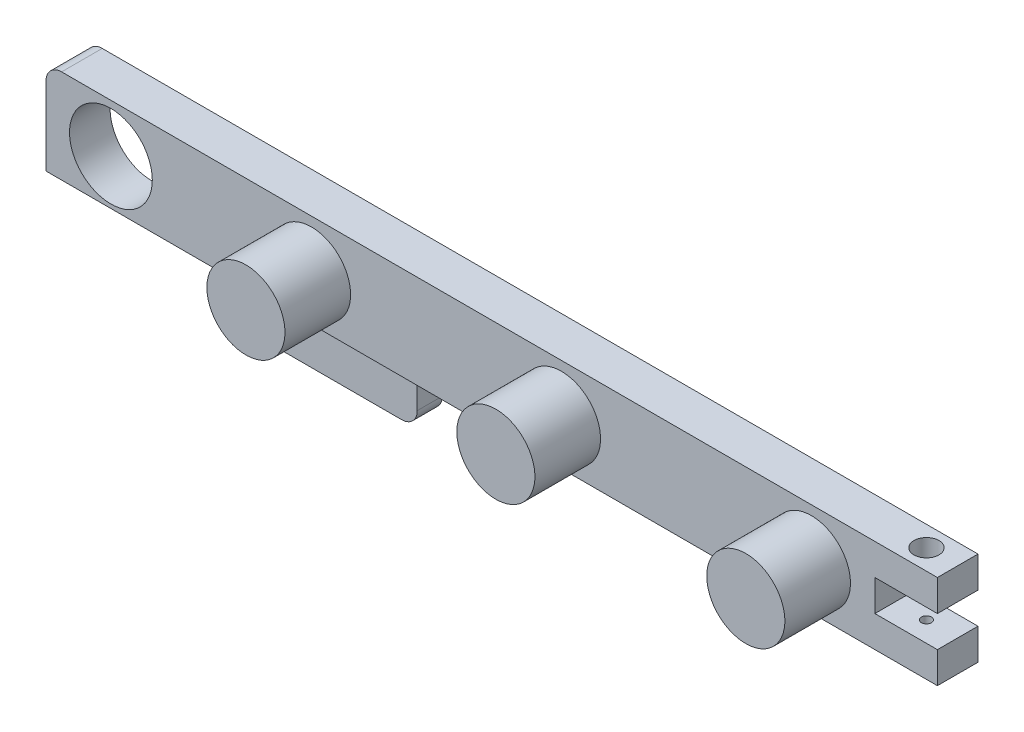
SolidWorks part; units mm, degrees
ref_plane "Front Plane" through (0, 0, 0) normal (0, 0, 1) x (1, 0, 0)
ref_plane "Top Plane" through (0, 0, 0) normal (0, 1, 0) x (1, 0, 0)
ref_plane "Right Plane" through (0, 0, 0) normal (1, 0, 0) x (0, 0, -1)
sketch "Sketch1" plane through (0, 0, 0) normal (0, 0, 1) x (1, 0, 0)
  line L1 (0, 0) -> (355.325, 0)
  line L2 (0, 0) -> (0, 30)
  line L3 (0, 30) -> (355.325, 30)
  line L4 (355.325, 0) -> (355.325, 30)
  line L5 (50, 0) -> (250, 0)
  line L6 (50, 0) -> (50, -17)
  line L7 (50, -17) -> (250, -17)
  line L8 (250, 0) -> (250, -17)
  line L9 (0, 0) -> (355.325, 0)
  line L10 (0, 0) -> (0, -17)
  line L11 (0, -17) -> (355.325, -17)
  line L12 (355.325, 0) -> (355.325, -17)
  line L13 (0, 0) -> (177.6625, 0)
  line L14 (0, 0) -> (0, -17)
  line L15 (0, -17) -> (177.6625, -17)
  line L16 (177.6625, 0) -> (177.6625, -17)
  line L17 (0, 0) -> (50, 0)
  line L18 (0, 0) -> (0, -5)
  line L19 (0, -5) -> (50, -5)
  line L20 (50, 0) -> (50, -5)
  circle A0 centre (20.775, 14.5) radius 12.5
  circle A1 centre (334.55, 14.5) radius 12.5
  circle A2 centre (60, -2.5) radius 1
  circle A3 centre (68, -2.5) radius 1
  circle A4 centre (60, -14.5) radius 1
  circle A5 centre (68, -14.5) radius 1
  dimension "D1" = 25
  dimension "D11" = 2
  dimension "D2" = 313.775
  dimension "D3" = 20.775
  dimension "D4" = 20.775
  dimension "D5" = 30
  dimension "D6" = 15.5
  dimension "D7" = 15.5
  dimension "D8" = 17
  dimension "D9" = 50
  dimension "D10" = 200
  dimension "D12" = 8
  dimension "D13" = 12
  dimension "D14" = 8
  dimension "D15" = 12
  dimension "D16" = 10
  dimension "D17" = 10
  dimension "D18" = 2.5
  dimension "D19" = 2.5
  dimension "D20" = 5
extrude "Boss-Extrude3" add sketch "Sketch1" along normal blind 13 contours L1 L9 L4 L3 L2 A1 A0 | L16 L1 L6 L7 A5 A4 A3 A2 | L10 L19 L6 L1
fillet "Fillet3" radius 5 6 edges at (355.325, 0, 6.5) (355.325, 30, 6.5) (177.6625, -17, 6.5) (50, -17, 6.5) (0, -5, 6.5) (0, 30, 6.5)
sketch "Sketch3" plane through (0, 0, 13) normal (0, 0, 1) x (1, 0, 0)
  line L0 (0, 0) -> (0, 25) construction
  circle A0 centre (85, 14.5) radius 12.5
  circle A1 centre (165, 14.5) radius 12.5
  circle A2 centre (245, 14.5) radius 12.5
  dimension "D1" = 25
  dimension "D2" = 85
  dimension "D3" = 80
  dimension "D4" = 80
extrude "Boss-Extrude4" add sketch "Sketch3" along normal blind 13
sketch "Sketch4" plane through (0, 0, 0) normal (0, 0, -1) x (-1, 0, 0)
  circle A0 centre (-68, -2.5) radius 1.425
  circle A1 centre (-60, -2.5) radius 1.425
  circle A2 centre (-60, -14.5) radius 1.425
  circle A3 centre (-68, -14.5) radius 1.425
  dimension "D1" = 2.85
extrude "Cut-Extrude1" cut sketch "Sketch4" against normal up to next
sketch "Sketch5" plane through (0, 0, 0) normal (0, 0, -1) x (-1, 0, 0)
  line L1 (-177.6625, 0) -> (-113.8325, 0)
  line L2 (-177.6625, 0) -> (-177.6625, -18)
  line L3 (-177.6625, -18) -> (-113.8325, -18)
  line L4 (-113.8325, 0) -> (-113.8325, -18)
  dimension "D1" = 63.83
  dimension "D2" = 18
extrude "Cut-Extrude3" cut sketch "Sketch5" against normal through all
fillet "Fillet4" radius 5 1 edges at (113.8325, -17, 6.5)
sketch "Sketch6" plane through (0, 0, 13) normal (0, 0, 1) x (1, 0, 0)
  line L1 (50, 0) -> (113.8325, 0)
  line L2 (50, 0) -> (50, -17)
  line L3 (50, -17) -> (113.8325, -17)
  line L4 (113.8325, 0) -> (113.8325, -17)
extrude "Cut-Extrude4" cut sketch "Sketch6" against normal blind 5
sketch "Sketch7" plane through (0, 0, 8) normal (0, 0, 1) x (1, 0, 0)
  circle A0 centre (60, -2.5) radius 1
  circle A1 centre (68, -2.5) radius 1
  circle A2 centre (68, -14.5) radius 1
  circle A3 centre (60, -14.5) radius 1
  circle A4 centre (60, -14.5) radius 2.1596
  circle A5 centre (60, -2.5) radius 2.1171
  circle A6 centre (68, -2.5) radius 1.9161
  circle A7 centre (68, -14.5) radius 2.4159
  dimension "D1" = 2
extrude "Boss-Extrude5" add sketch "Sketch7" against normal blind 8
sketch "Sketch8" plane through (0, 0, 26) normal (0, 0, 1) x (1, 0, 0)
  circle A0 centre (85, 14.5) radius 12.5
  circle A1 centre (165, 14.5) radius 12.5
  circle A2 centre (245, 14.5) radius 12.5
extrude "Boss-Extrude6" add sketch "Sketch8" along normal blind 13
sketch "Sketch10" plane through (0, 0, 13) normal (0, 0, 1) x (1, 0, 0)
  line L0 (50, 0) -> (350.325, 0) construction
  line L1 (355.325, 30) -> (285.325, 30)
  line L2 (355.325, 30) -> (355.325, 0)
  line L3 (355.325, 0) -> (285.325, 0)
  line L4 (285.325, 30) -> (285.325, 0)
  line L5 (5, 30) -> (350.325, 30) construction
  line L6 (285.325, 20) -> (265.325, 20)
  line L7 (285.325, 20) -> (285.325, 10)
  line L8 (285.325, 10) -> (265.325, 10)
  line L9 (265.325, 20) -> (265.325, 10)
  line L10 (355.325, 5) -> (355.325, 25) construction
  dimension "D1" = 70
  dimension "D2" = 20
  dimension "D3" = 10
  dimension "D4" = 10
extrude "Cut-Extrude6" cut sketch "Sketch10" against normal through all contours L6 L9 L8 L4 | L4 M9 M5 M6 M7 M8 M17
sketch "Sketch11" plane through (0, 0, 13) normal (0, 0, 1) x (1, 0, 0)
  circle A0 centre (20.775, 14.5) radius 13.25
  dimension "D1" = 26.5
extrude "Cut-Extrude7" cut sketch "Sketch11" against normal through all
sketch "Sketch12" plane through (0, 0, 8) normal (0, 0, 1) x (1, 0, 0)
  circle A0 centre (60, -2.5) radius 1.25
  circle A1 centre (68, -2.5) radius 1.25
  circle A2 centre (68, -14.5) radius 1.25
  circle A3 centre (60, -14.5) radius 1.25
  dimension "D1" = 2.5
extrude "Cut-Extrude8" cut sketch "Sketch12" against normal through all
sketch "Sketch15" plane through (0, 30, 0) normal (0, 1, 0) x (1, 0, 0)
  line L1 (5, 0) -> (285.325, 0) construction
  line L2 (285.325, 0) -> (285.325, -13) construction
  circle A0 centre (275.325, -6.5) radius 1.6
  dimension "D1" = 3.2
  dimension "D2" = 6.5
  dimension "D3" = 10
extrude "Cut-Extrude10" cut sketch "Sketch15" against normal through all
sketch "Sketch17" plane through (0, 30, 0) normal (0, 1, 0) x (1, 0, 0)
  circle A0 centre (275.325, -6.5) radius 4
  dimension "D1" = 8
extrude "Cut-Extrude11" cut sketch "Sketch17" against normal blind 7.5
sketch "Sketch18" plane through (0, 0, 0) normal (0, -1, 0) x (1, 0, 0)
  circle A0 centre (275.325, 6.5) radius 4.25
  dimension "D1" = 8.5
extrude "Cut-Extrude12" cut sketch "Sketch18" against normal blind 7.5
sketch "Sketch19" plane through (0, 0, 13) normal (0, 0, 1) x (1, 0, 0)
  line L1 (50, 0) -> (-2.5375, 0)
  line L2 (50, 0) -> (50, -17.902)
  line L3 (50, -17.902) -> (-2.5375, -17.902)
  line L4 (-2.5375, 0) -> (-2.5375, -17.902)
extrude "Cut-Extrude13" cut sketch "Sketch19" against normal blind 5
sketch "Sketch20" plane through (0, 0, 39) normal (0, 0, 1) x (1, 0, 0)
  circle A0 centre (85, 14.5) radius 12.5
  circle A1 centre (165, 14.5) radius 12.5
  circle A2 centre (245, 14.5) radius 12.5
extrude "Cut-Extrude14" cut sketch "Sketch20" against normal blind 5
